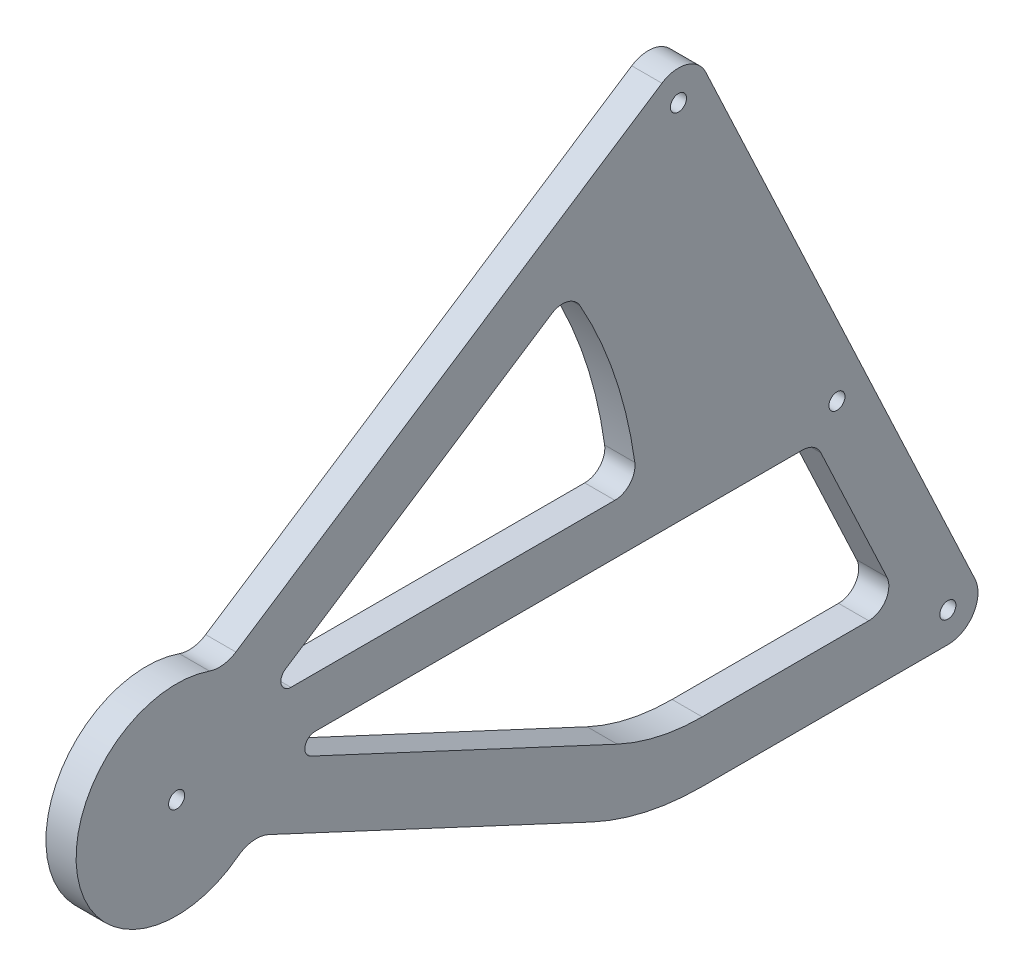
SolidWorks part; units mm, degrees
ref_plane "Alzado" through (0, 0, 0) normal (0, 0, 1) x (1, 0, 0)
ref_plane "Planta" through (0, 0, 0) normal (0, 1, 0) x (1, 0, 0)
ref_plane "Vista lateral" through (0, 0, 0) normal (1, 0, 0) x (0, 0, -1)
sketch "Croquis1" plane through (0, 0, 0) normal (1, 0, 0) x (0, 0, -1)
  line L0 (14331.1531, 4738.6666) -> (14374.3566, 4767.0157)
  line L1 (14172.6537, 4598.7809) -> (14304.9451, 4685.5876)
  line L2 (14374.3566, 4767.0157) -> (14525.706, 4444.6006)
  line L3 (14438.9337, 4558.8499) -> (14471.7934, 4488.8499)
  line L4 (14379.9454, 4444.6006) -> (14525.706, 4444.6006)
  line L5 (14379.9454, 4474.6006) -> (14462.7411, 4474.6006)
  line L6 (14185.2108, 4555.069) -> (14337.6836, 4483.9698)
  line L7 (14155.4436, 4535.8483) -> (14325.005, 4456.7806)
  line L8 (14175.3967, 4589.6006) -> (14336.4997, 4589.6006)
  line L9 (14187.3238, 4564.6006) -> (14429.8815, 4564.6006)
  line L10 (14141.3328, 4614.1108) -> (14338.5922, 4743.5479)
  arc A0 (14141.3328, 4614.1108) -> (14155.4436, 4535.8483) centre (14118.5547, 4569.6006) ccw
  arc A1 (14438.9337, 4558.8499) -> (14429.8815, 4564.6006) centre (14429.8815, 4554.6006) ccw
  arc A2 (14346.4063, 4600.9642) -> (14319.1529, 4682.1189) centre (14118.5547, 4569.6006) ccw
  arc A3 (14319.1529, 4682.1189) -> (14304.9451, 4685.5876) centre (14310.4312, 4677.2268) ccw
  arc A4 (14336.4997, 4589.6006) -> (14346.4063, 4600.9642) centre (14336.4997, 4599.6006) ccw
  arc A5 (14462.7411, 4474.6006) -> (14471.7934, 4488.8499) centre (14462.7411, 4484.6006) ccw
  arc A6 (14337.6836, 4483.9698) -> (14379.9454, 4474.6006) centre (14379.9454, 4574.6006) ccw
  arc A7 (14325.005, 4456.7806) -> (14379.9454, 4444.6006) centre (14379.9454, 4574.6006) ccw
  arc A8 (14187.3238, 4564.6006) -> (14185.2108, 4555.069) centre (14187.3238, 4559.6006) ccw
  arc A9 (14172.6537, 4598.7809) -> (14175.3967, 4589.6006) centre (14175.3967, 4594.6006) ccw
  circle A10 centre (14118.5547, 4569.6006) radius 4
extrude "Saliente-Extruir1" add sketch "Croquis1" along normal blind 15 contours L7 A7 L4 L2 L0 L10 A0 A10 A9 L1 A3 A2 A4 L8 A8 L9 A1 L3 A5 L5 A6 L6
fillet "Redondeo1" radius 15 4 edges at (7.5, 4444.6006, -14525.706) (7.5, 4767.0157, -14374.3566) (7.5, 4535.8483, -14155.4436) (7.5, 4614.1108, -14141.3328)
sketch "Croquis2" plane through (15, 0, 0) normal (1, 0, 0) x (0, 0, -1)
  line L0 (14368.127, 4744.987) -> (14502.0942, 4459.6006) construction
  line L1 (14187.3238, 4564.6006) -> (14429.8815, 4564.6006) construction
  line L4 (14269.3966, 4577.1006) -> (14446.9369, 4577.1006) construction
  circle A0 centre (14368.127, 4744.987) radius 4
  circle A1 centre (14502.0942, 4459.6006) radius 4
  circle A2 centre (14446.9369, 4577.1006) radius 4
  dimension "D1" = 8
  dimension "D2" = 12.5
extrude "Cortar-Extruir1" cut sketch "Croquis2" against normal through all
